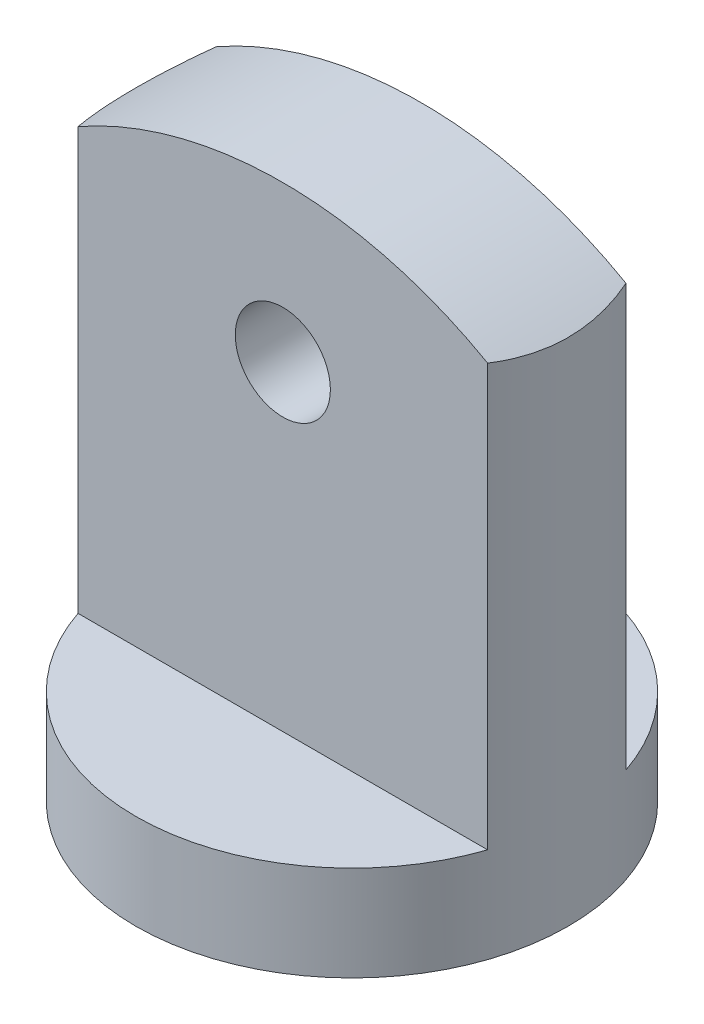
SolidWorks part; units mm, degrees
ref_plane "Front Plane" through (0, 0, 0) normal (0, 0, 1) x (1, 0, 0)
ref_plane "Top Plane" through (0, 0, 0) normal (0, 1, 0) x (1, 0, 0)
ref_plane "Right Plane" through (0, 0, 0) normal (1, 0, 0) x (0, 0, -1)
sketch "Sketch1" plane through (0, 0, 0) normal (0, 1, 0) x (1, 0, 0)
  circle A0 centre (0, 0) radius 2.5
  dimension "D1" = 5
extrude "Boss-Extrude1" add sketch "Sketch1" along normal blind 1.1
sketch "Sketch3" plane through (0, 0, 0) normal (0, 0, 1) x (1, 0, 0)
  line L0 (2.5, 1.1) -> (-2.5, 1.1) construction
  line L1 (-2.5, 1.1) -> (2.5, 1.1)
  line L2 (-2.5, 1.1) -> (-2.5, 6.6)
  line L3 (-2.5, 6.6) -> (2.5, 6.6)
  line L4 (2.5, 1.1) -> (2.5, 6.6)
  dimension "D1" = 5
  dimension "D2" = 2.5
  dimension "D3" = 5.5
extrude "Boss-Extrude2" add sketch "Sketch3" along normal mid plane 1.6
sketch "Sketch4" plane through (0, 0, 0.8) normal (0, 0, 1) x (1, 0, 0)
  line L0 (-2.5, 6.6) -> (-2.5, 1.1) construction
  line L1 (2.5, 1.1) -> (2.5, 6.6) construction
  line L2 (2.5, 6.6) -> (-2.5, 6.6) construction
  line L3 (2.5, 6.6) -> (-2.5, 6.6) construction
  arc A0 (-2.5, 5.8976) -> (2.5, 5.8976) centre (0, 1.8) cw
  dimension "D1" = 4.8
  dimension "D2" = 5
extrude "Cut-Extrude1" cut sketch "Sketch4" against normal through all and the other way through all
sketch "Sketch5" plane through (0, 0, 0.8) normal (0, 0, 1) x (1, 0, 0)
  line L0 (-2.5, 0) -> (2.5, 0) construction
  circle A0 centre (0, 4.8) radius 0.55
  dimension "D1" = 1.1
  dimension "D2" = 4.8
extrude "Cut-Extrude2" cut sketch "Sketch5" against normal blind 1.6
sketch "Sketch6" plane through (0, 1.1, 0) normal (0, 1, 0) x (1, 0, 0)
  circle A0 centre (0, 0) radius 2.5
  circle A1 centre (0, 0) radius 2.75
  dimension "D1" = 5
  dimension "D2" = 5.5
extrude "Cut-Extrude4" cut sketch "Sketch6" along normal blind 5.6
sketch "Sketch7" plane through (0, 0, 0) normal (0, -1, 0) x (1, 0, 0)
  circle A0 centre (0, 0) radius 1
  dimension "D1" = 2
extrude "Cut-Extrude5" cut sketch "Sketch7" against normal blind 1
